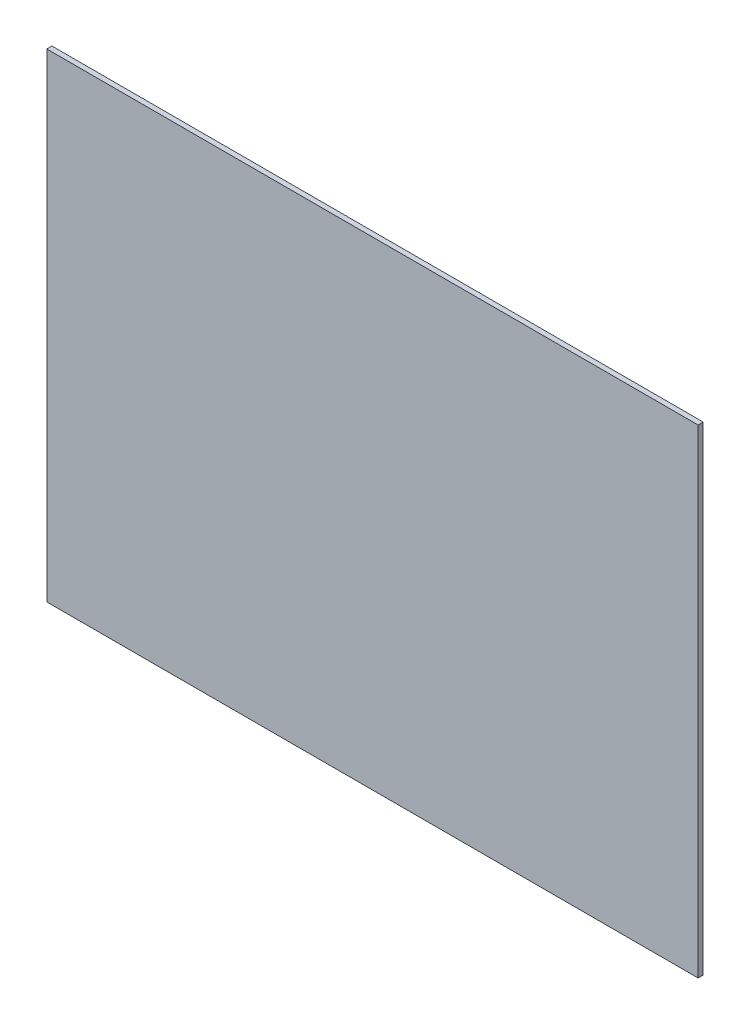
SolidWorks part; units mm, degrees
ref_plane "Ebene vorne" through (0, 0, 0) normal (0, 0, 1) x (1, 0, 0)
ref_plane "Ebene oben" through (0, 0, 0) normal (0, 1, 0) x (1, 0, 0)
ref_plane "Ebene rechts" through (0, 0, 0) normal (1, 0, 0) x (0, 0, -1)
sketch "Skizze1" plane through (0, 0, 0) normal (0, 0, 1) x (1, 0, 0)
  line L1 (-255, -187.5) -> (255, -187.5)
  line L2 (-255, -187.5) -> (-255, 187.5)
  line L3 (-255, 187.5) -> (255, 187.5)
  line L4 (255, -187.5) -> (255, 187.5)
  line L5 (-255, -187.5) -> (255, 187.5) construction
  line L6 (-255, 187.5) -> (255, -187.5) construction
  point P0 (0, 0)
  dimension "D1" = 510
  dimension "D2" = 375
extrude "Aufsatz-Linear austragen1" add sketch "Skizze1" along normal blind 4
